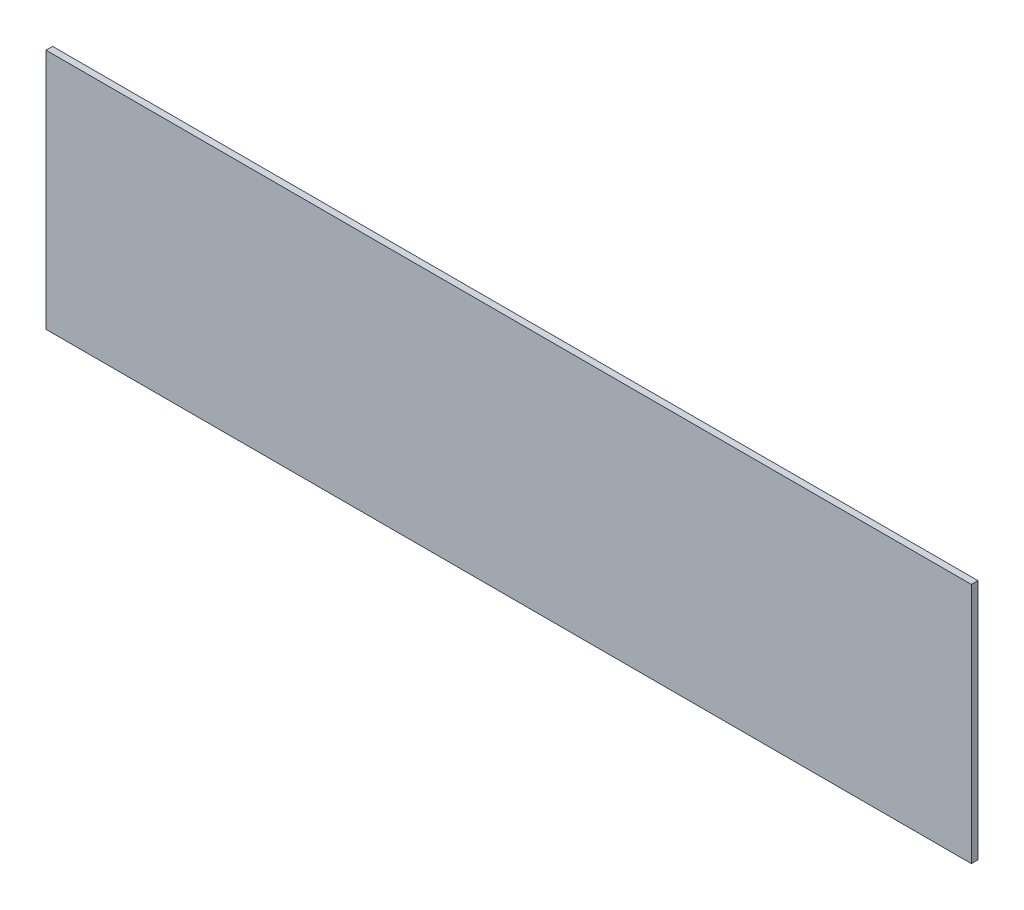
SolidWorks part; units mm, degrees
ref_plane "Alzado" through (0, 0, 0) normal (0, 0, 1) x (1, 0, 0)
ref_plane "Planta" through (0, 0, 0) normal (0, 1, 0) x (1, 0, 0)
ref_plane "Vista lateral" through (0, 0, 0) normal (1, 0, 0) x (0, 0, -1)
sketch "Sketch1" plane through (0, 0, 0) normal (0, 0, 1) x (1, 0, 0)
  line L1 (0, 0) -> (421, 0)
  line L2 (0, 0) -> (0, 110)
  line L3 (0, 110) -> (421, 110)
  line L4 (421, 0) -> (421, 110)
  dimension "D1" = 110
  dimension "D2" = 421
extrude "Boss-Extrude1" add sketch "Sketch1" along normal blind 3
